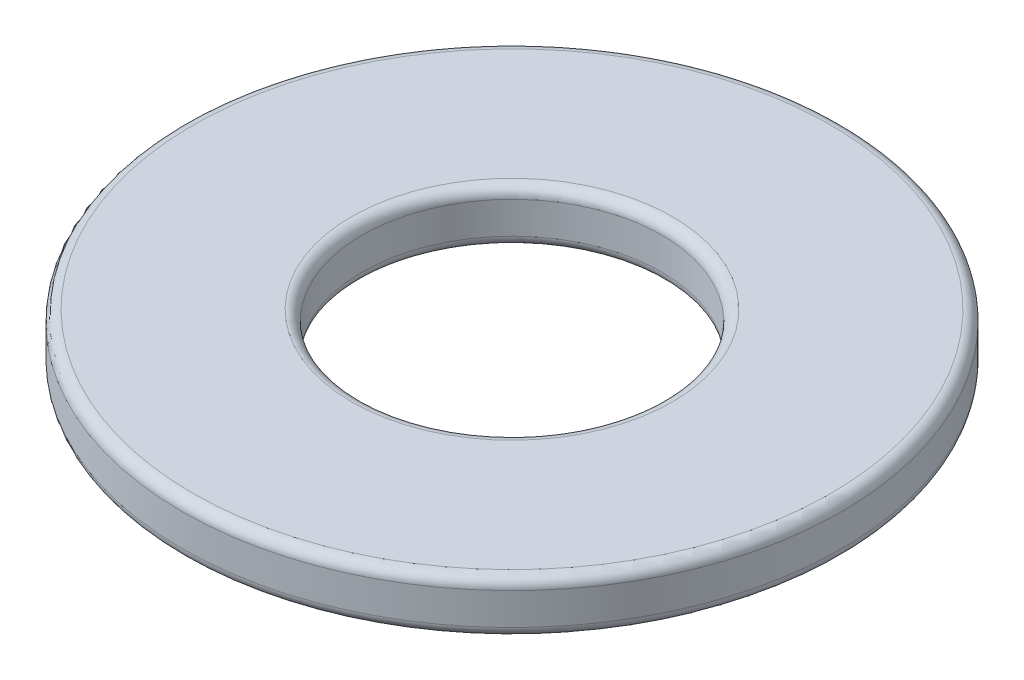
SolidWorks part; units mm, degrees
ref_plane "Front" through (0, 0, 0) normal (0, 0, 1) x (1, 0, 0)
ref_plane "Top" through (0, 0, 0) normal (0, 1, 0) x (1, 0, 0)
ref_plane "Right" through (0, 0, 0) normal (1, 0, 0) x (0, 0, -1)
sketch "Sketch1" plane through (0, 0, 0) normal (0, 1, 0) x (1, 0, 0)
  circle A0 centre (0, 0) radius 2.8575
  circle A1 centre (0, 0) radius 6.2865
  dimension "D1" = 5.715
  dimension "D2" = 12.573
extrude "Extrude1" add sketch "Sketch1" along normal blind 1.016
fillet "Fillet1" radius 0.2032 4 edges at (0, 0, 6.2865) (0, 1.016, 6.2865) (0, 0, 2.8575) (0, 1.016, 2.8575)
